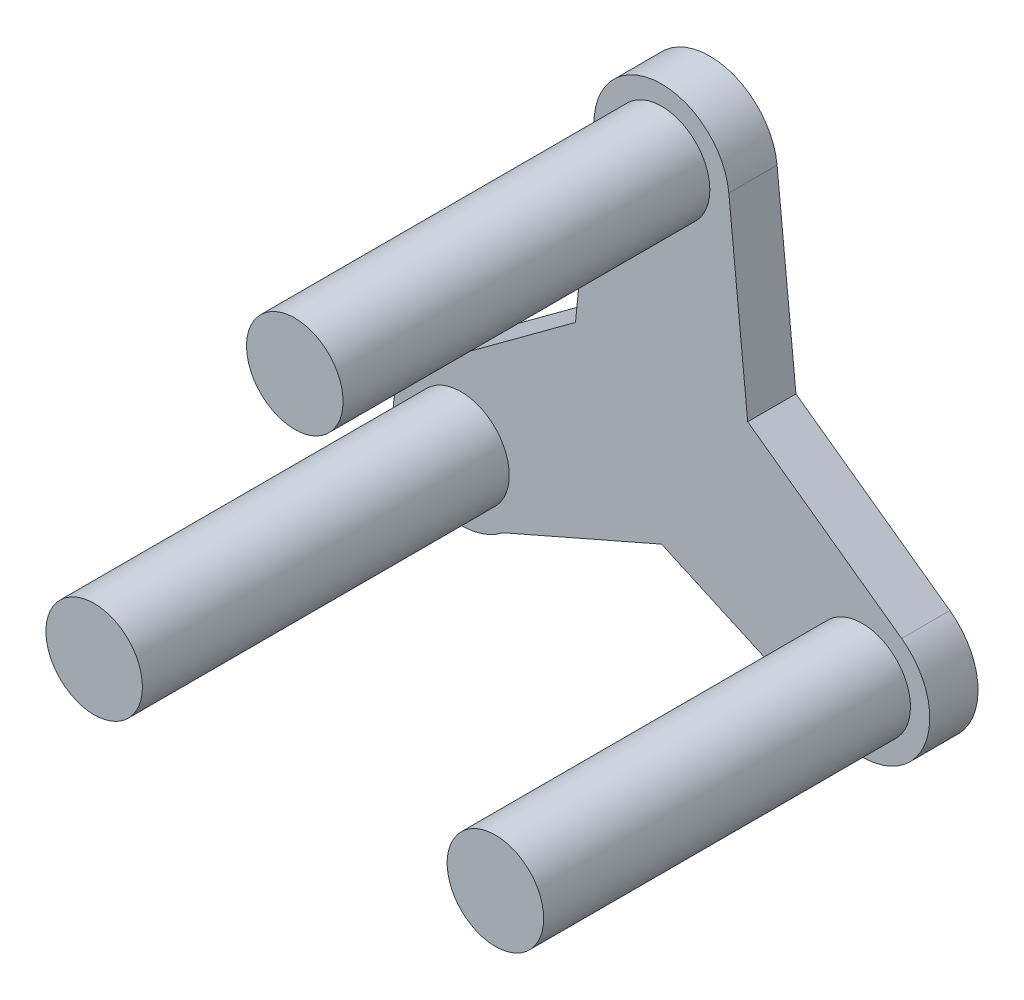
SolidWorks part; units mm, degrees
ref_plane "Piano frontale" through (0, 0, 0) normal (0, 0, 1) x (1, 0, 0)
ref_plane "Piano superiore" through (0, 0, 0) normal (0, 1, 0) x (1, 0, 0)
ref_plane "Piano destro" through (0, 0, 0) normal (1, 0, 0) x (0, 0, -1)
sketch "Schizzo1" plane through (0, 0, 0) normal (0, 0, 1) x (1, 0, 0)
  line L0 (0, -14.1573) -> (0, 18.9825) construction
  line L1 (-4.5, 2.1794) -> (-3.4826, 12.3484)
  line L2 (4.5, 2.1794) -> (3.4826, 12.3484)
  line L3 (4.1375, 2.8074) -> (12.4354, -3.1582)
  line L4 (-0.3625, -4.9868) -> (8.9527, -9.1902)
  line L5 (0.3625, -4.9868) -> (-8.219, -8.7435)
  line L6 (-4.1375, 2.8074) -> (-11.6816, -2.7461)
  line L7 (10.3923, -6) -> (0, 0) construction
  line L8 (-10.3923, -6) -> (0, 0) construction
  circle A0 centre (0, 0) radius 12 construction
  circle A1 centre (0, 12) radius 3.5
  circle A2 centre (10.3923, -6) radius 3.5
  circle A3 centre (-10.3923, -6) radius 3.5
  circle A4 centre (0, 0) radius 5
  point P13 (0, 0)
  dimension "D1" = 24
  dimension "D2" = 7
  dimension "D4" = 10
  dimension "D5" = 9
  dimension "D6" = 9
  dimension "D7" = 9
  dimension "D3" = 3
extrude "Estrusione-Estrusione1" add sketch "Schizzo1" along normal blind 2.5 contours A1 | A2 | A4 L4 A2 L3 | A4 | A4 L2 A1 L1 | A4 L6 A3 L5 | A3 | A4 L6 L1 | A4 L2 L3 | A4 L4 L5
sketch "Schizzo2" plane through (0, 0, 2.5) normal (0, 0, 1) x (1, 0, 0)
  circle A0 centre (0, 12) radius 2.5
  circle A1 centre (10.3923, -6) radius 2.5
  circle A2 centre (-10.3923, -6) radius 2.5
  point P9 (0, 0)
  dimension "D1" = 5
extrude "Estrusione-Estrusione2" add sketch "Schizzo2" along normal blind 19
sketch "Schizzo3" plane through (0, 0, 0) normal (0, 1, 0) x (1, 0, 0)
  line L0 (0, -21.5) -> (0, 2.5815) construction
  line L1 (-2.5, -21.5) -> (2.5, -21.5) construction
